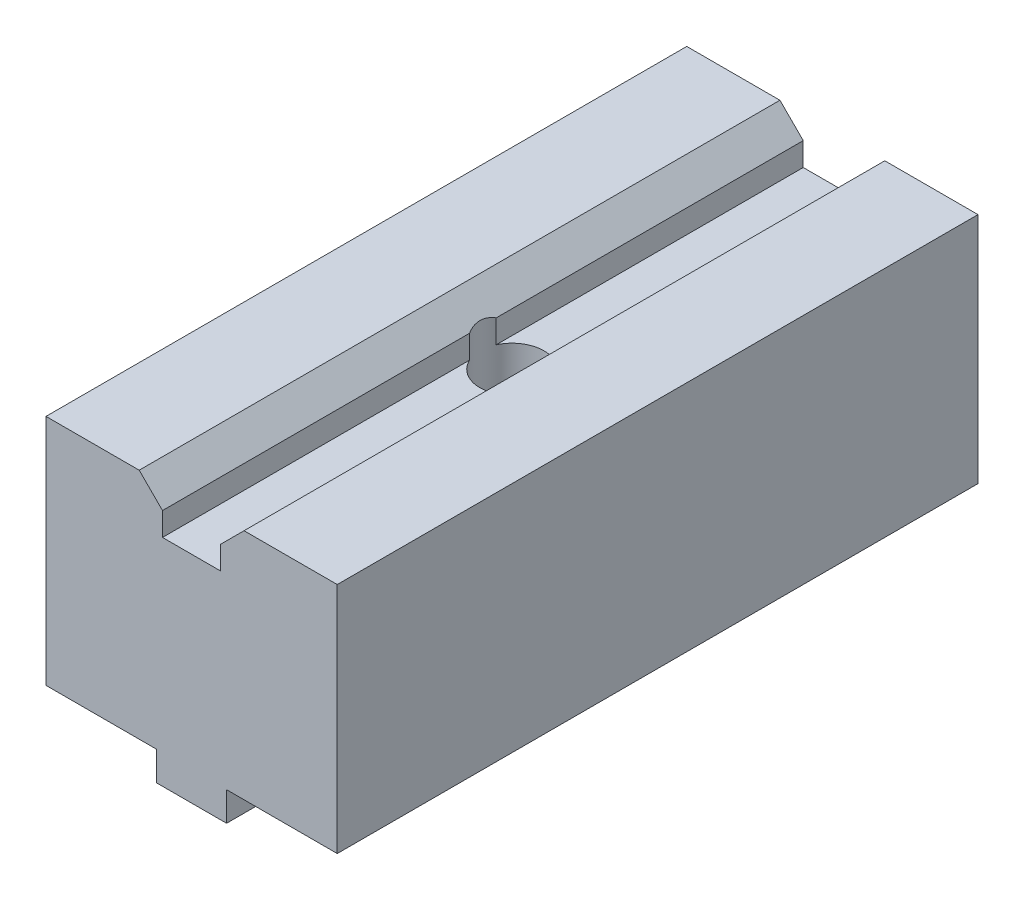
SolidWorks part; units mm, degrees
ref_plane "Ebene vorne" through (0, 0, 0) normal (0, 0, 1) x (1, 0, 0)
ref_plane "Ebene oben" through (0, 0, 0) normal (0, 1, 0) x (1, 0, 0)
ref_plane "Ebene rechts" through (0, 0, 0) normal (1, 0, 0) x (0, 0, -1)
sketch "Skizze1" plane through (0, 0, 0) normal (0, 0, 1) x (1, 0, 0)
  line L0 (0, 0) -> (0, 36.7409) construction
  line L1 (12.5, 0) -> (-12.5, 0)
  line L2 (-12.5, 0) -> (-12.5, 20)
  line L3 (-12.5, 20) -> (-4.5, 20)
  line L4 (-4.5, 20) -> (-2.5, 18)
  line L5 (-2.5, 18) -> (-2.5, 16)
  line L6 (-2.5, 16) -> (2.5, 16)
  line L7 (2.5, 18) -> (2.5, 16)
  line L8 (4.5, 20) -> (2.5, 18)
  line L9 (12.5, 20) -> (4.5, 20)
  line L10 (12.5, 0) -> (12.5, 20)
  point P10 (0, 16)
  dimension "D1" = 45
  dimension "D2" = 5
  dimension "D3" = 2
  dimension "D4" = 4
  dimension "D5" = 20
  dimension "D6" = 25
extrude "Aufsatz-Linear austragen1" add sketch "Skizze1" along normal mid plane 55
sketch "Skizze2" plane through (0, 0, 27.5) normal (0, 0, 1) x (1, 0, 0)
  line L0 (0, 0) -> (0, 16) construction
  line L1 (2.5, 16) -> (-2.5, 16) construction
  line L2 (-3, 0) -> (-3, 2.5)
  line L3 (-12.5, 0) -> (12.5, 0) construction
  line L4 (-3, 2.5) -> (3, 2.5)
  line L5 (3, 2.5) -> (3, 0)
  line L6 (3, 0) -> (-3, 0)
  dimension "D1" = 6
  dimension "D2" = 2.5
extrude "Schnitt-Linear austragen1" [suppressed] cut sketch "Skizze2" against normal through all
hole_wizard "Stirnsenkung für M2.5 Zylinderschraube mit Innensechskant1" positions "Skizze4" profile "Skizze3" counterbore size "M2.5" standard "DIN"
sketch "Skizze4" plane through (0, 20, 0) normal (0, 1, 0) x (-1, 0, 0)
  line L0 (19.6897, 0) -> (-20.8949, 0) construction
  line L3 (0, -26.4488) -> (0, 27.1366) construction
  point P0 (0, -15)
  dimension "D1" = 30
sketch "Skizze3" plane through (0, 20, -15) normal (1, 0, 0) x (0, 0, 1)
  line L0 (0, 0) -> (0, 20)
  line L1 (0, 20) -> (1.45, 20)
  line L3 (1.45, 20) -> (1.45, 10)
  line L4 (1.45, 10) -> (2.75, 10)
  line L5 (2.75, 10) -> (2.75, 0)
  line L7 (2.75, 0) -> (0, 0)
  line L11 (0, -6.35) -> (0, 107.95) construction
  dimension "Bohrerdurchmesser" = 2.9
  dimension "Bohrungstiefe" = 20
  dimension "Senkdurchmesser2" = 5.5
  dimension "Senktiefe2" = 10
mirror "Spiegeln1" [suppressed] about plane through (0, 0, 0) normal (0, 0, 1)
sketch "Skizze5" plane through (0, 0, 27.5) normal (0, 0, 1) x (1, 0, 0)
  line L0 (-3, -2.5) -> (-3, 0)
  line L1 (-12.5, 0) -> (12.5, 0) construction
  line L2 (-3, 0) -> (3, 0)
  line L3 (3, 0) -> (3, -2.5)
  line L4 (3, -2.5) -> (-3, -2.5)
  line L5 (0, -1.4875) -> (0, 1.5942) construction
  dimension "D1" = 6
  dimension "D2" = 2.5
extrude "Aufsatz-Linear austragen2" add sketch "Skizze5" against normal through all
hole_wizard "Stirnsenkung für M2.5 Zylinderschraube mit Innensechskant2" positions "Skizze7" profile "Skizze6" counterbore size "M2.5" standard "DIN"
sketch "Skizze7" plane through (0, 20, 0) normal (0, 1, 0) x (-1, 0, 0)
  point P0 (0, 0)
sketch "Skizze6" plane through (0, 20, 0) normal (1, 0, 0) x (0, 0, 1)
  line L0 (0, 0) -> (0, 22.5)
  line L1 (0, 22.5) -> (1.45, 22.5)
  line L3 (1.45, 22.5) -> (1.45, 10)
  line L4 (1.45, 10) -> (2.75, 10)
  line L5 (2.75, 10) -> (2.75, 0)
  line L7 (2.75, 0) -> (0, 0)
  line L11 (0, -6.35) -> (0, 107.95) construction
  dimension "Bohrerdurchmesser" = 2.9
  dimension "Bohrungstiefe" = 22.5
  dimension "Senkdurchmesser2" = 5.5
  dimension "Senktiefe2" = 10
